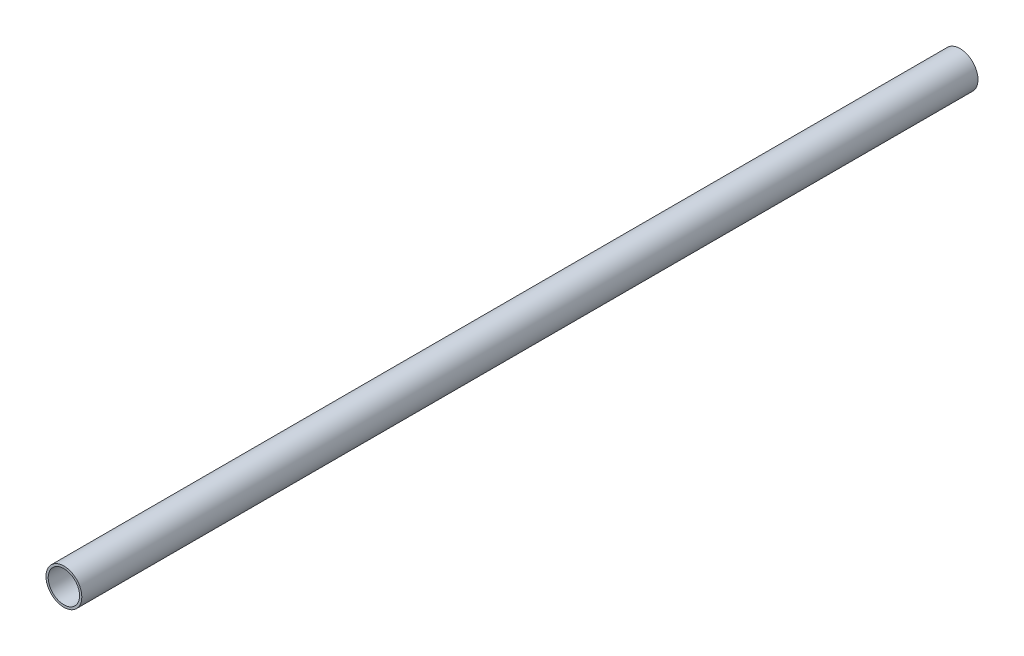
SolidWorks part; units mm, degrees
ref_plane "前视基准面" through (0, 0, 0) normal (0, 0, 1) x (1, 0, 0)
ref_plane "上视基准面" through (0, 0, 0) normal (0, 1, 0) x (1, 0, 0)
ref_plane "右视基准面" through (0, 0, 0) normal (1, 0, 0) x (0, 0, -1)
other "Configuration Table"
sketch "草图1" plane through (0, 0, 0) normal (0, 0, 1) x (1, 0, 0)
  circle A0 centre (0, 0) radius 8
  circle A1 centre (0, 0) radius 7
extrude "凸台-拉伸1" add sketch "草图1" along normal blind 400
